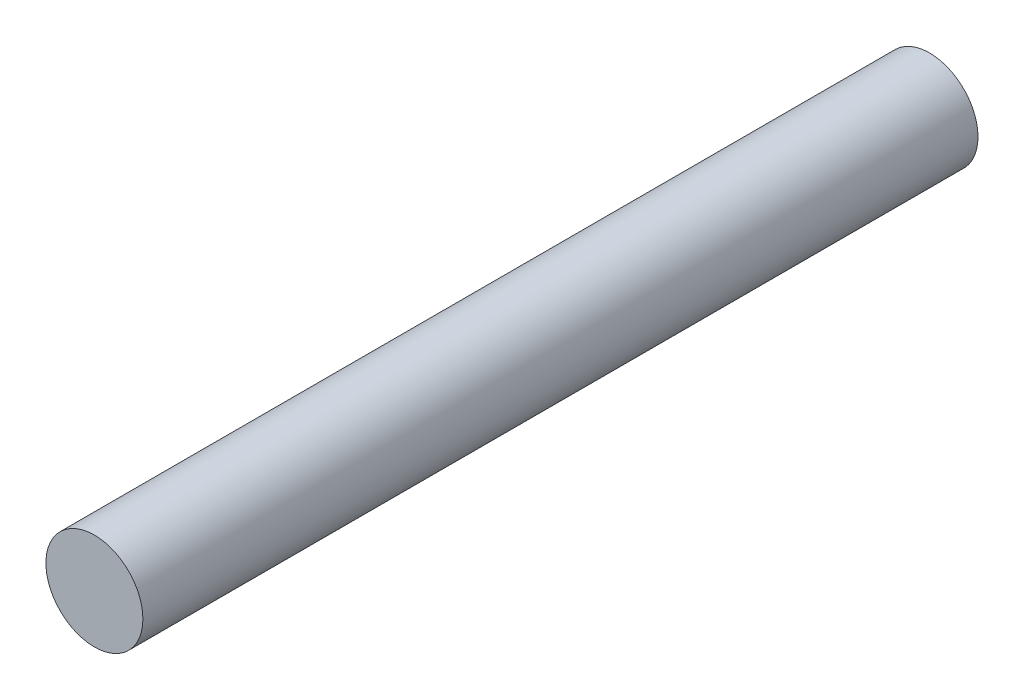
SolidWorks part; units mm, degrees
ref_plane "Front" through (0, 0, 0) normal (0, 0, 1) x (1, 0, 0)
ref_plane "Top" through (0, 0, 0) normal (0, 1, 0) x (1, 0, 0)
ref_plane "Right" through (0, 0, 0) normal (1, 0, 0) x (0, 0, -1)
sketch "Esquisse1" plane through (0, 0, 0) normal (0, 0, 1) x (1, 0, 0)
  circle A0 centre (0, 0) radius 9
  dimension "D1" = 18
extrude "Boss.-Extru.1" add sketch "Esquisse1" along normal blind 155
